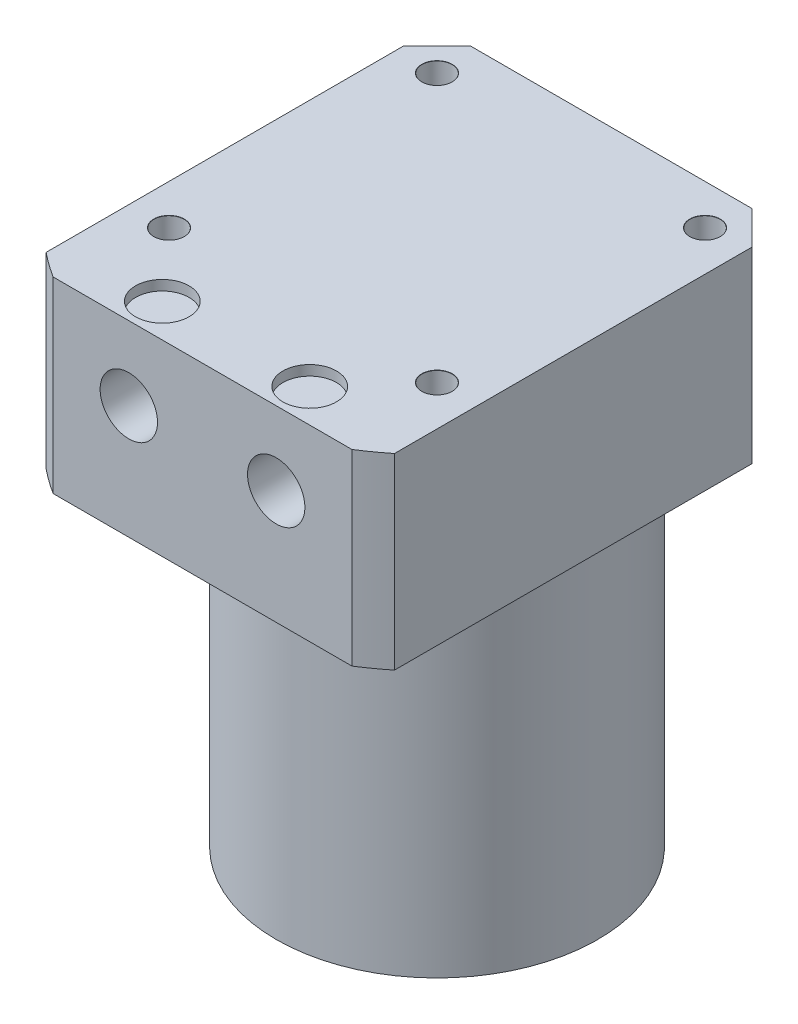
SolidWorks part; units mm, degrees
ref_plane "Front Plane" through (0, 0, 0) normal (0, 0, 1) x (1, 0, 0)
ref_plane "Top Plane" through (0, 0, 0) normal (0, 1, 0) x (1, 0, 0)
ref_plane "Right Plane" through (0, 0, 0) normal (1, 0, 0) x (0, 0, -1)
sketch "Sketch1" plane through (0, 0, 0) normal (0, 0, 1) x (1, 0, 0)
  line L0 (0, 87.0508) -> (0, 0) construction
  line L1 (0, 0) -> (-24, 0)
  line L2 (-24, 0) -> (-24, 52)
  line L3 (-24, 52) -> (-41.5, 52)
  line L4 (-41.5, 52) -> (-41.5, 80)
  line L6 (-41.5, 80) -> (0, 80)
  line L7 (0, 0) -> (0, 80)
  dimension "D1" = 24
  dimension "D2" = 52
  dimension "D3" = 41.5
  dimension "D5" = 28
revolve "Revolve1" add sketch "Sketch1" angle 360 about L0
sketch "Sketch2" plane through (0, 80, 0) normal (0, 1, 0) x (1, 0, 0)
  line L0 (0, 0) -> (0, 26) construction
  line L1 (-26, 26) -> (26, 26)
  line L2 (-26, 26) -> (-26, -35)
  line L3 (-26, -35) -> (26, -35)
  line L4 (26, 26) -> (26, -35)
  dimension "D1" = 61
  dimension "D2" = 52
  dimension "D3" = 26
extrude "Cut-Extrude2" cut sketch "Sketch2" against normal through all flip side to cut
chamfer "Chamfer1" distance 5 angle 45 2 edges at (26, 66, -26) (-26, 66, -26)
hole_wizard "Ø8.0 (8) Diameter Hole1" positions "Sketch4" profile "Sketch3" hole size "Ø8.0" standard "ISO"
sketch "Sketch4" plane through (-22.9405, 80, 22.7051) normal (0, -1, 0) x (1, 0, 0)
  line L0 (11.9405, 7.2949) -> (33.9405, 7.2949) construction
  line L2 (22.9405, 7.2949) -> (22.9405, -22.7051) construction
  point P0 (11.9405, 7.2949)
  point P1 (33.9405, 7.2949)
  dimension "D1" = 22
  dimension "D2" = 30
sketch "Sketch3" plane through (-11, 80, 30) normal (1, 0, 0) x (0, 0, 1)
  line L0 (0, 0) -> (0, 1.5)
  line L1 (0, 1.5) -> (4, 1.5)
  line L2 (4, 1.5) -> (4, 0)
  line L5 (4, 0) -> (0, 0)
  line L10 (0, 1.5) -> (-4, 1.5) construction
  line L11 (0, -6.35) -> (0, 107.95) construction
  dimension "Hole Dia." = 8
  dimension "Hole Depth" = 1.5
  dimension "Drill Angle" = 180
hole_wizard "G1/8 Tapped Hole1" positions "Sketch6" profile "Sketch5" tap size "G1/8" standard "ISO"
sketch "Sketch6" plane through (0, 0, 35) normal (0, 0, 1) x (1, 0, 0)
  line L0 (-11, 69) -> (11, 69) construction
  line L4 (0, 69) -> (0, 80) construction
  line L5 (-22.2991, 80) -> (22.2991, 80) construction
  point P0 (-11, 69)
  point P1 (11, 69)
  dimension "D1" = 11
  dimension "D2" = 22
sketch "Sketch5" plane through (-11, 69, 35) normal (1, 0, 0) x (0, -1, 0)
  line L0 (0, 0) -> (0, 22.18)
  line L1 (0, 22.18) -> (4.283, 22.18)
  line L2 (4.283, 22.18) -> (4.283, 0)
  line L5 (4.283, 0) -> (0, 0)
  line L10 (0, 22.18) -> (-4.283, 22.18) construction
  line L11 (0, -6.35) -> (0, 107.95) construction
  dimension "Tap Drill Dia." = 8.566
  dimension "Tap Drill Depth" = 22.18
  dimension "Drill Angle" = 180
hole_wizard "CBORE for M4 Hex Socket Head Cap Screw1" positions "Sketch8" profile "Sketch7" counterbore size "M4" standard "ISO"
sketch "Sketch8" plane through (-33.2535, 52, 49.2524) normal (0, 1, 0) x (-1, 0, 0)
  line L1 (-13.2535, -29.2524) -> (-53.2535, -29.2524)
  line L2 (-13.2535, -29.2524) -> (-13.2535, -69.2524)
  line L3 (-13.2535, -69.2524) -> (-53.2535, -69.2524)
  line L4 (-53.2535, -29.2524) -> (-53.2535, -69.2524)
  line L7 (-33.2535, -49.2524) -> (-33.2535, -29.2524) construction
  line L9 (-33.2535, -49.2524) -> (-13.2535, -49.2524) construction
  point P0 (-13.2535, -69.2524)
  point P1 (-53.2535, -69.2524)
  point P3 (-53.2535, -29.2524)
  point P5 (-13.2535, -29.2524)
  dimension "D1" = 40
  dimension "D2" = 40
sketch "Sketch7" plane through (-20, 52, -20) normal (1, 0, 0) x (0, 0, -1)
  line L0 (0, 0) -> (0, 28)
  line L1 (2.25, 27.975) -> (2.275, 28)
  line L2 (2.25, 27.975) -> (2.25, 4)
  line L3 (2.25, 4) -> (4, 4)
  line L4 (4, 4) -> (4, 0)
  line L5 (4, 0) -> (0, 0)
  line L11 (0, -6.35) -> (0, 107.95) construction
  line L12 (2.275, 28) -> (0, 28)
  line L13 (-2.25, 27.975) -> (-2.275, 28) construction
  dimension "Thru Hole Dia." = 4.5
  dimension "Thru Hole Depth" = 28
  dimension "C'Bore Dia." = 8
  dimension "C'Bore Depth" = 4
  dimension "Far C'Sink Dia." = 4.55
  dimension "Far C'Sink Angle" = 90
